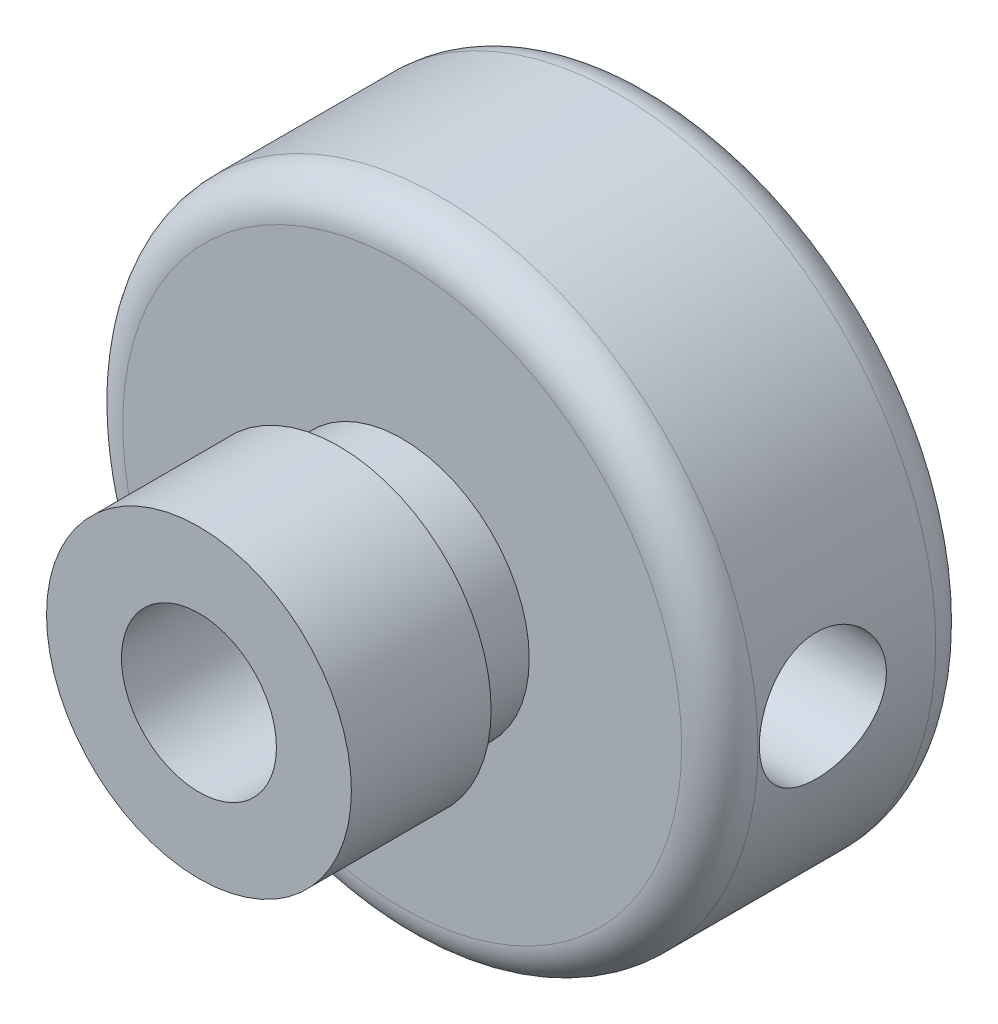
SolidWorks part; units mm, degrees
ref_plane "Plan1" through (0, 0, 0) normal (0, 0, 1) x (1, 0, 0)
ref_plane "Plan2" through (0, 0, 0) normal (0, 1, 0) x (1, 0, 0)
ref_plane "Plan3" through (0, 0, 0) normal (1, 0, 0) x (0, 0, -1)
sketch "Esquisse1" plane through (0, 0, 0) normal (0, 0, 1) x (1, 0, 0)
  circle A0 centre (0, 0) radius 12.5
  dimension "D1" = 25
extrude "Base-Extrusion" add sketch "Esquisse1" along normal blind 10
sketch "Esquisse2" plane through (0, 0, 10) normal (0, 0, 1) x (1, 0, 0)
  circle A0 centre (0, 0) radius 6
  dimension "D1" = 12
extrude "Boss.-Extru.1" add sketch "Esquisse2" along normal blind 8
sketch "Esquisse3" plane through (0, 0, 18) normal (0, 0, 1) x (1, 0, 0)
  circle A0 centre (0, 0) radius 3.05
  dimension "D1" = 6.1
extrude "Enlèv. mat.-Extru.1" cut sketch "Esquisse3" against normal through all
sketch "Esquisse4" plane through (0, 0, 0) normal (0, 0, -1) x (-1, 0, 0)
  circle A0 centre (0, 0) radius 5
  dimension "D1" = 10
extrude "Enlèv. mat.-Extru.2" cut sketch "Esquisse4" against normal blind 8
sketch "Esquisse5" plane through (0, 0, 0) normal (1, 0, 0) x (0, 0, -1)
  line L0 (-21.3998, 0) -> (3.3457, 0) construction
  line L1 (-8, 0) -> (-18, 0) construction
  line L2 (-10, 7) -> (-12.5, 7)
  line L3 (-10, 7) -> (-10, 5)
  line L4 (-12.5, 5) -> (-10, 5)
  line L5 (-12.5, 5) -> (-12.5, 7)
  line L6 (-10, 12.5) -> (-10, -12.5) construction
  line L7 (-18, 6) -> (-18, -6) construction
  dimension "D1" = 5.5
revolve "Enlever de la matière-Révolution1" cut sketch "Esquisse5" angle 360 about L0
fillet "Congé1" radius 1.5
ref_plane "Plan4" through (12.5, 0, 0) normal (1, 0, 0) x (0, 0, -1)
sketch "Esquisse7" plane through (12.5, 0, 0) normal (1, 0, 0) x (0, 0, -1)
  line L0 (-8, 0) -> (-18, 0) construction
  circle A0 centre (-5.9424, 0) radius 2.5
  dimension "D1" = 5
extrude "Enlèv. mat.-Extru.4" cut sketch "Esquisse7" against normal blind 8
